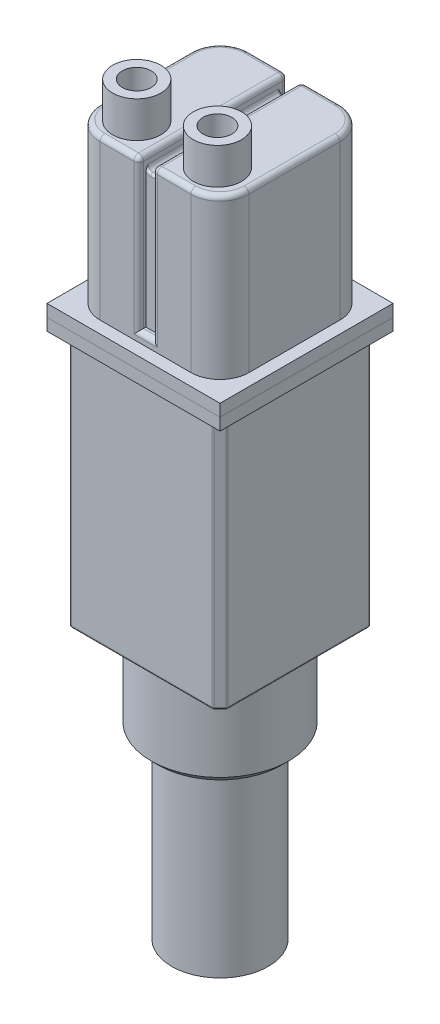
SolidWorks part; units mm, degrees
ref_plane "Ön Düzlem" through (0, 0, 0) normal (0, 0, 1) x (1, 0, 0)
ref_plane "Üst Düzlem" through (0, 0, 0) normal (0, 1, 0) x (1, 0, 0)
ref_plane "Sağ Düzlem" through (0, 0, 0) normal (1, 0, 0) x (0, 0, -1)
sketch "Çizim1" plane through (0, 0, 0) normal (0, 1, 0) x (1, 0, 0)
  circle A0 centre (0, 0) radius 20
  dimension "D1" = 40
extrude "Yükseklik-Ekstrüzyon1" add sketch "Çizim1" along normal blind 75
sketch "Çizim2" plane through (0, 75, 0) normal (0, 1, 0) x (1, 0, 0)
  circle A0 centre (0, 0) radius 28.5
  dimension "D1" = 57
extrude "Yükseklik-Ekstrüzyon2" add sketch "Çizim2" along normal blind 38
sketch "Çizim3" plane through (0, 113, 0) normal (0, 1, 0) x (1, 0, 0)
  line L1 (-32.5, -32.5) -> (32.5, -32.5)
  line L2 (-32.5, -32.5) -> (-32.5, 32.5)
  line L3 (-32.5, 32.5) -> (32.5, 32.5)
  line L4 (32.5, -32.5) -> (32.5, 32.5)
  line L5 (-32.5, -32.5) -> (32.5, 32.5) construction
  line L6 (-32.5, 32.5) -> (32.5, -32.5) construction
  point P0 (0, 0)
  dimension "D1" = 65
  dimension "D2" = 65
extrude "Yükseklik-Ekstrüzyon3" add sketch "Çizim3" along normal blind 105
sketch "Çizim4" plane through (0, 218, 0) normal (0, 1, 0) x (1, 0, 0)
  line L1 (-32.5, -32.5) -> (32.5, -32.5)
  line L2 (-32.5, -32.5) -> (-32.5, 32.5)
  line L3 (-32.5, 32.5) -> (32.5, 32.5)
  line L4 (32.5, -32.5) -> (32.5, 32.5)
  line L5 (-32.5, -32.5) -> (32.5, 32.5) construction
  line L6 (-32.5, 32.5) -> (32.5, -32.5) construction
  line L7 (-35.858, -35.858) -> (35.858, -35.858)
  line L8 (-35.858, -35.858) -> (-35.858, 35.858)
  line L9 (-35.858, 35.858) -> (35.858, 35.858)
  line L10 (35.858, -35.858) -> (35.858, 35.858)
  line L11 (-35.858, -35.858) -> (35.858, 35.858) construction
  line L12 (-35.858, 35.858) -> (35.858, -35.858) construction
  point P0 (0, 0)
  point P7 (0, 0)
extrude "Yükseklik-Ekstrüzyon4" add sketch "Çizim4" along normal blind 5 contours M4 M1 M2 M3 | L7 L10 L9 L8 M1 M4 M3 M2
sketch "Çizim5" plane through (0, 223, 0) normal (0, 1, 0) x (1, 0, 0)
  line L1 (-35.858, -35.858) -> (35.858, -35.858)
  line L2 (-35.858, -35.858) -> (-35.858, 35.858)
  line L3 (-35.858, 35.858) -> (35.858, 35.858)
  line L4 (35.858, -35.858) -> (35.858, 35.858)
  line L5 (-35.858, -35.858) -> (35.858, 35.858) construction
  line L6 (-35.858, 35.858) -> (35.858, -35.858) construction
  point P0 (0, 0)
extrude "Yükseklik-Ekstrüzyon5" add sketch "Çizim5" along normal blind 5 separate body
sketch "Çizim6" plane through (0, 228, 0) normal (0, 1, 0) x (1, 0, 0)
  line L0 (-35.858, 35.858) -> (-35.858, -35.858) construction
  line L1 (-30.858, 30.858) -> (-0.5177, 30.858)
  line L2 (-30.858, 30.858) -> (-30.858, -30.858)
  line L3 (-30.858, -30.858) -> (-0.5177, -30.858)
  line L4 (-0.5177, 30.858) -> (-0.5177, -30.858)
  line L5 (-0.5177, 30.858) -> (30.858, 30.858)
  line L6 (-0.5177, 30.858) -> (-0.5177, -30.858)
  line L7 (-0.5177, -30.858) -> (30.858, -30.858)
  line L8 (30.858, 30.858) -> (30.858, -30.858)
  line L9 (35.858, 35.858) -> (-35.858, 35.858) construction
  line L10 (35.858, -35.858) -> (35.858, 35.858) construction
  line L11 (-35.858, -35.858) -> (35.858, -35.858) construction
  dimension "D1" = 5
  dimension "D2" = 5
  dimension "D3" = 5
  dimension "D5" = 5
extrude "Yükseklik-Ekstrüzyon6" add sketch "Çizim6" along normal blind 66 contours L4 L1 L2 L3 | L8 L5 L4 L7
sketch "Çizim7" plane through (0, 294, 0) normal (0, 1, 0) x (1, 0, 0)
  line L0 (-30.858, 30.858) -> (30.858, 30.858) construction
  line L1 (-2.858, 30.858) -> (2.858, 30.858)
  line L2 (-2.858, 30.858) -> (-2.858, -30.858)
  line L3 (-2.858, -30.858) -> (2.858, -30.858)
  line L4 (2.858, 30.858) -> (2.858, -30.858)
  line L5 (-30.858, -30.858) -> (30.858, -30.858) construction
  line L6 (-30.858, 30.858) -> (-30.858, -30.858) construction
  line L7 (30.858, 30.858) -> (30.858, -30.858) construction
  dimension "D1" = 28
  dimension "D2" = 28
extrude "Kes-Ekstrüzyon1" cut sketch "Çizim7" against normal blind 6
sketch "Çizim8" plane through (0, 288, 0) normal (0, 1, 0) x (1, 0, 0)
  line L0 (2.858, -30.858) -> (2.858, 30.858) construction
  line L1 (-2.858, 30.858) -> (2.858, 30.858)
  line L2 (-2.858, 30.858) -> (-2.858, 27.858)
  line L3 (-2.858, 27.858) -> (2.858, 27.858)
  line L4 (2.858, 30.858) -> (2.858, 27.858)
  line L5 (2.858, -30.858) -> (2.858, 30.858) construction
  line L6 (-2.858, -30.858) -> (2.858, -30.858)
  line L7 (-2.858, -30.858) -> (-2.858, -27.858)
  line L8 (-2.858, -27.858) -> (2.858, -27.858)
  line L9 (2.858, -30.858) -> (2.858, -27.858)
  dimension "D1" = 3
  dimension "D2" = 3
extrude "Kes-Ekstrüzyon2" cut sketch "Çizim8" against normal blind 56
fillet "Radyus1" radius 2 4 edges at (-2.858, 294, 0) (2.858, 294, 0) (2.858, 288, 0) (-2.858, 288, 0)
fillet "Radyus2" radius 2 14 edges at (-2.858, 262, -30.858) (-3.4438, 293.4142, -30.858) (-2.858, 262, 30.858) (-3.4438, 293.4142, 30.858) (2.858, 262, 30.858) (3.4438, 293.4142, 30.858) (2.858, 262, -30.858) (3.4438, 293.4142, -30.858) (-30.858, 294, 0) (-17.858, 294, -30.858) (-17.858, 294, 30.858) (30.858, 294, 0) (17.858, 294, 30.858) (17.858, 294, -30.858)
fillet "Radyus3" radius 12 8 edges at (-30.2722, 293.4142, 30.2722) (30.2722, 293.4142, 30.2722) (-30.2722, 293.4142, -30.2722) (30.2722, 293.4142, -30.2722) (30.858, 260, -30.858) (-30.858, 260, -30.858) (30.858, 260, 30.858) (-30.858, 260, 30.858)
chamfer "Pah1" distance 3 angle 45 4 edges at (32.5, 165.5, 32.5) (-32.5, 165.5, 32.5) (32.5, 165.5, -32.5) (-32.5, 165.5, -32.5)
fillet "Radyus4" radius 1 16 edges at (31, 113, 31) (0, 113, 32.5) (-31, 113, 31) (-32.5, 113, 0) (-31, 113, -31) (31, 113, -31) (32.5, 113, 0) (0, 113, -32.5) (32.5, 165.5, -29.5) (29.5, 165.5, -32.5) (-29.5, 165.5, -32.5) (-32.5, 165.5, -29.5) (32.5, 165.5, 29.5) (29.5, 165.5, 32.5) (-32.5, 165.5, 29.5) (-29.5, 165.5, 32.5)
chamfer "Pah2" distance 3 angle 45 1 edges at (0, 75, 28.5)
sketch "Çizim9" plane through (0, 294, 0) normal (0, 1, 0) x (1, 0, 0)
  line L0 (0, 27.858) -> (0, 18.5235)
  line L1 (-2.858, 27.858) -> (2.858, 27.858) construction
  circle A0 centre (-16.7137, -17.7783) radius 10
  circle A1 centre (16.7137, -17.7783) radius 10
  circle A2 centre (-16.7137, -17.7783) radius 6
  circle A3 centre (16.7137, -17.7783) radius 6
  dimension "D1" = 20
  dimension "D2" = 12
  dimension "D3" = 12
extrude "Yükseklik-Ekstrüzyon7" add sketch "Çizim9" along normal blind 15 contours A0 A2 | A1 A3
fillet "Radyus5" radius 1 6 edges at (-2.2722, 288.5858, -27.858) (2.2722, 288.5858, -27.858) (2.2722, 288.5858, 27.858) (0, 288, 27.858) (0, 288, -27.858) (-2.2722, 288.5858, 27.858)
fillet "Radyus6" radius 2 2 edges at (0, 232, -30.858) (0, 232, 30.858)
